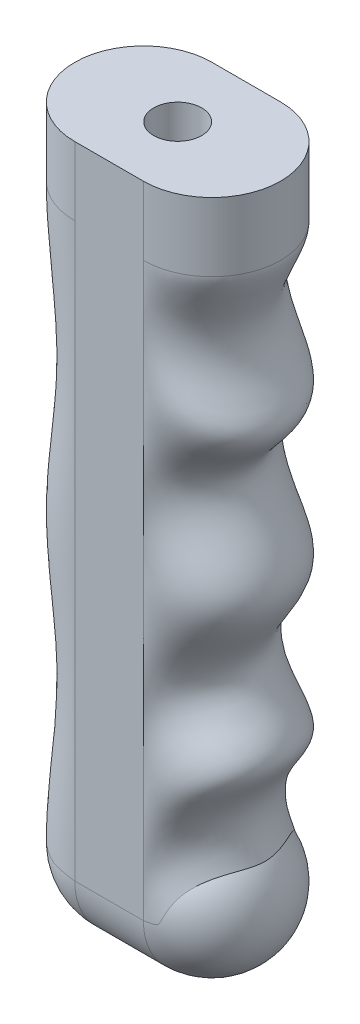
SolidWorks part; units mm, degrees
ref_plane "Front Plane" through (0, 0, 0) normal (0, 0, 1) x (1, 0, 0)
ref_plane "Top Plane" through (0, 0, 0) normal (0, 1, 0) x (1, 0, 0)
ref_plane "Right Plane" through (0, 0, 0) normal (1, 0, 0) x (0, 0, -1)
sketch "Sketch1" plane through (0, 0, 0) normal (0, 1, 0) x (0, 0, -1)
  line L0 (0, 0) -> (0, 10) construction
  line L1 (0, 10) -> (0, -5) construction
  line L4 (15, 10) -> (15, -5)
  line L5 (-15, 10) -> (-15, -5)
  arc A2 (15, 10) -> (-15, 10) centre (0, 10) ccw
  arc A3 (-15, -5) -> (15, -5) centre (0, -5) ccw
  point P3 (0, 2.5)
  dimension "D1" = 15
  dimension "D2" = 10
  dimension "D3" = 30
extrude "Boss-Extrude1" add sketch "Sketch1" along normal blind 125
other "Freeform1"
other "Freeform2"
sketch "Sketch4" plane through (0, 0, 0) normal (0, -1, 0) x (1, 0, 0)
  line L1 (-25, 0) -> (20, 0) construction
  line L6 (-25, 0) -> (20, 0)
  line L8 (-10, -15) -> (5, -15)
  line L9 (5, 15) -> (-10, 15)
  line L11 (5, 15) -> (-10, 15)
  arc A2 (-10, 15) -> (-10, -15) centre (-10, 0) ccw construction
  arc A3 (5, -15) -> (5, 15) centre (5, 0) ccw construction
  arc A9 (-10, 15) -> (-10, -15) centre (-10, 0) ccw
  arc A10 (5, -15) -> (5, 15) centre (5, 0) ccw
  arc A11 (-10, 15) -> (-25, 0) centre (-10, 0) ccw
  arc A12 (20, 0) -> (5, 15) centre (5, 0) ccw
  dimension "D1" = 0
sketch "Sketch5" plane through (0, 125, 0) normal (0, 1, 0) x (1, 0, 0)
  line L2 (-10, -15) -> (5, -15)
  line L3 (-10, -15) -> (5, -15)
  line L6 (5, 15) -> (-10, 15)
  line L7 (5, 15) -> (-10, 15)
  arc A2 (-10, 15) -> (-10, -15) centre (-10, 0) ccw
  arc A3 (5, -15) -> (5, 15) centre (5, 0) ccw
  arc A4 (-10, 15) -> (-10, -15) centre (-10, 0) ccw
  arc A6 (5, -15) -> (5, 15) centre (5, 0) ccw
  dimension "D1" = 0
extrude "Boss-Extrude2" add sketch "Sketch5" along normal blind 15
revolve "Revolve3" add sketch "Sketch4" angle 360 about L1
hole_wizard "M12x1.5 Tapped Hole1" positions "Sketch8" profile "Sketch7" tap size "M12x1.5" standard "ANSI Metric"
sketch "Sketch8" plane through (0, 140, 0) normal (0, 1, 0) x (1, 0, 0)
  line L0 (-25, 0) -> (20, 0) construction
  line L1 (-2.5, 0) -> (-2.5, 9.5509) construction
  arc A0 (-10, 15) -> (-10, -15) centre (-10, 0) ccw construction
  arc A1 (5, -15) -> (5, 15) centre (5, 0) ccw construction
  point P9 (-2.5, 0)
sketch "Sketch7" plane through (-2.5, 140, 0) normal (1, 0, 0) x (0, 0, 1)
  line L0 (0, 0) -> (0, 34.6545)
  line L1 (0, 34.6545) -> (5.25, 31.5)
  line L2 (5.25, 31.5) -> (5.25, 0)
  line L5 (5.25, 0) -> (0, 0)
  line L10 (0, 34.6545) -> (-5.25, 31.5) construction
  line L11 (0, -6.35) -> (0, 107.95) construction
  dimension "Tap Drill Dia." = 10.5
  dimension "Tap Drill Depth" = 31.5
  dimension "Drill Angle" = 118
sketch "Sketch9" plane through (0, 0, 0) normal (0, 0, 1) x (1, 0, 0)
  line L0 (-83.1836, 127.337) -> (-83.1836, 10.4512)
